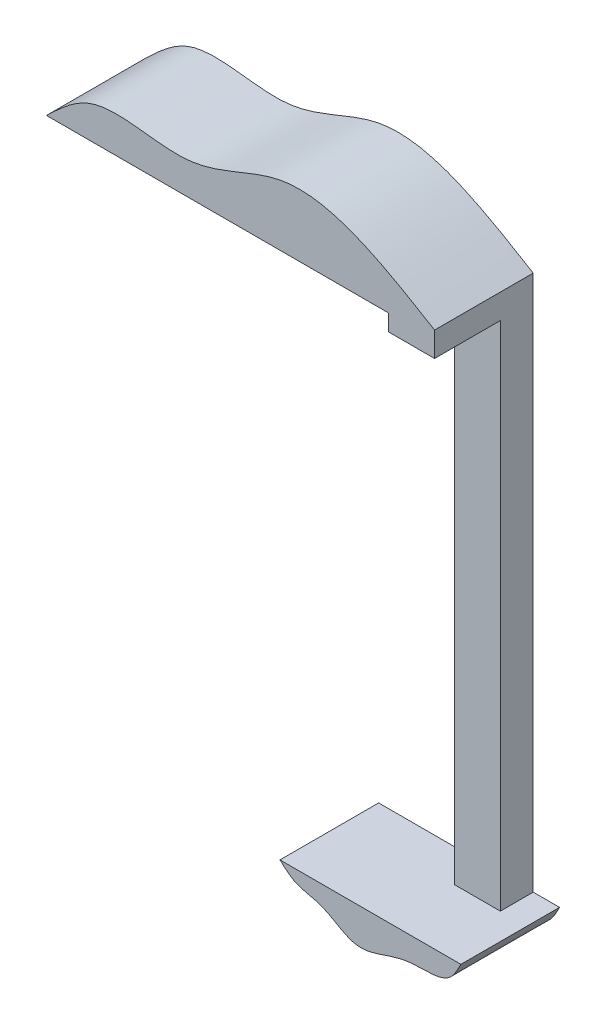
SolidWorks part; units mm, degrees
ref_plane "Plan1" through (0, 0, 0) normal (0, 0, 1) x (1, 0, 0)
ref_plane "Plan2" through (0, 0, 0) normal (0, 1, 0) x (1, 0, 0)
ref_plane "Plan3" through (0, 0, 0) normal (1, 0, 0) x (0, 0, -1)
sketch "Esquisse1" plane through (0, 0, 0) normal (0, 0, 1) x (1, 0, 0)
  line L0 (-35, 0) -> (-2, 0)
  line L1 (-2, 0) -> (-2, 160.5)
  line L2 (12, 0) -> (12, 163)
  line L3 (-2, 160.5) -> (-106, 160.5)
  line L4 (12, 0) -> (20, 0)
  spline_without_curve S0
  spline_without_curve S1
  dimension "D1" = 35
  dimension "D2" = 20
  dimension "D3" = 2
  dimension "D4" = 12
  dimension "D5" = 160.5
  dimension "D6" = 163
  dimension "D7" = 104
extrude "Base-Extrusion" add sketch "Esquisse1" along normal blind 30
sketch "Esquisse2" plane through (0, 0, 30) normal (0, 0, 1) x (1, 0, 0)
  line L0 (-106, 160.5) -> (-2, 160.5) construction
  line L1 (-14.1, 155.5) -> (12, 155.5)
  line L2 (-14.1, 155.5) -> (-14.1, 0)
  line L3 (-14.1, 0) -> (12, 0)
  line L4 (12, 155.5) -> (12, 0)
  dimension "D1" = 5
extrude "Enlèv. mat.-Extru.1" cut sketch "Esquisse2" against normal blind 20
